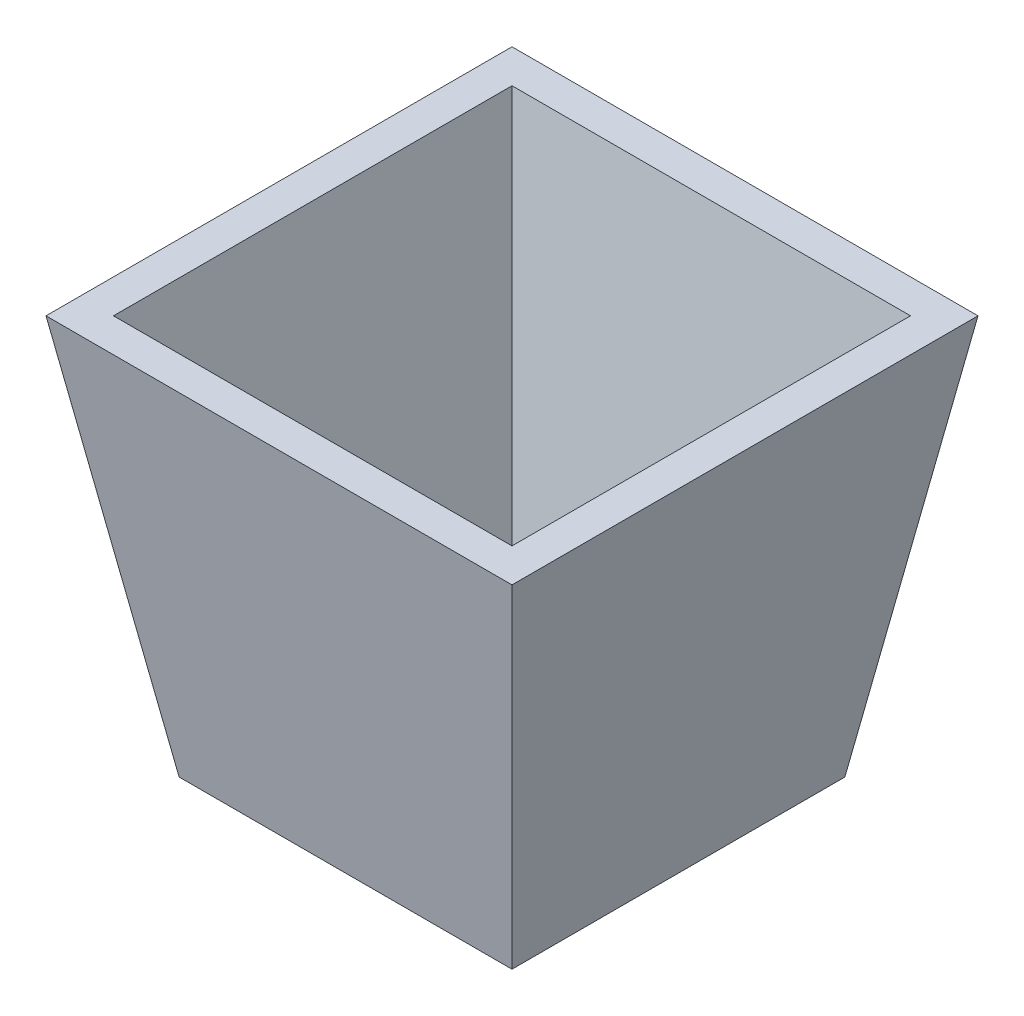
SolidWorks part; units mm, degrees
ref_plane "Front Plane" through (0, 0, 0) normal (0, 0, 1) x (1, 0, 0)
ref_plane "Top Plane" through (0, 0, 0) normal (0, 1, 0) x (1, 0, 0)
ref_plane "Right Plane" through (0, 0, 0) normal (1, 0, 0) x (0, 0, -1)
sketch "Sketch1" plane through (0, 0, 0) normal (0, 1, 0) x (1, 0, 0)
  line L1 (-50, 50) -> (50, 50)
  line L2 (-50, 50) -> (-50, -50)
  line L3 (-50, -50) -> (50, -50)
  line L4 (50, 50) -> (50, -50)
  line L5 (-50, 50) -> (50, -50) construction
  line L6 (-50, -50) -> (50, 50) construction
  point P0 (0, 0)
  dimension "D1" = 100
ref_plane "Plane1" through (0, 120, 0) normal (0, 1, 0) x (1, 0, 0)
sketch "Sketch2" plane through (0, 120, 0) normal (0, 1, 0) x (1, 0, 0)
  line L1 (-70, 70) -> (70, 70)
  line L2 (-70, 70) -> (-70, -70)
  line L3 (-70, -70) -> (70, -70)
  line L4 (70, 70) -> (70, -70)
  line L5 (-70, 70) -> (70, -70) construction
  line L6 (-70, -70) -> (70, 70) construction
  point P0 (0, 0)
  dimension "D1" = 140
loft "Loft1" add profiles "Sketch2", "Sketch1"
shell "Shell1" thickness 10
sketch "Sketch3" plane through (0, 10, 0) normal (0, 1, 0) x (1, 0, 0)
  line L1 (-41.5287, 41.5287) -> (41.5287, 41.5287)
  line L2 (-41.5287, 41.5287) -> (-41.5287, -41.5287)
  line L3 (-41.5287, -41.5287) -> (41.5287, -41.5287)
  line L4 (41.5287, 41.5287) -> (41.5287, -41.5287)
  line L5 (-41.5287, 41.5287) -> (41.5287, -41.5287) construction
  line L6 (-41.5287, -41.5287) -> (41.5287, 41.5287) construction
  point P0 (0, 0)
extrude "Cut-Extrude1" cut sketch "Sketch3" against normal through all both and the other way through all
